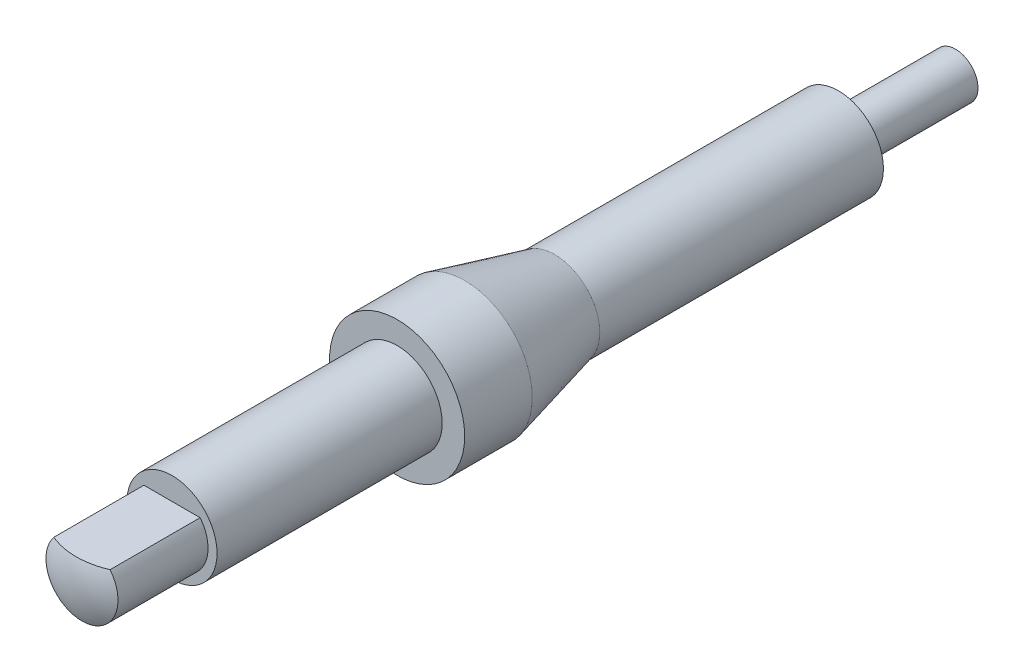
SolidWorks part; units mm, degrees
ref_plane "Front" through (0, 0, 0) normal (0, 0, 1) x (1, 0, 0)
ref_plane "Top" through (0, 0, 0) normal (0, 1, 0) x (1, 0, 0)
ref_plane "Right" through (0, 0, 0) normal (1, 0, 0) x (0, 0, -1)
sketch "Sketch1" plane through (0, 0, 0) normal (1, 0, 0) x (0, 0, -1)
  line L0 (-2.0578, 0) -> (195.2549, 0)
  line L2 (0, 8) -> (20, 8)
  line L3 (20, 8) -> (20, 10)
  line L4 (20, 10) -> (70, 10)
  line L5 (70, 10) -> (70, 15)
  line L6 (70, 15) -> (85, 15)
  line L7 (85, 15) -> (105, 10)
  line L8 (105, 10) -> (168, 10)
  line L9 (168, 10) -> (168, 5)
  line L10 (168, 5) -> (194, 5)
  arc A1 (0, 8) -> (-2.0578, 0) centre (14.5213, 0) ccw
  arc A2 (195.2549, 0) -> (194, 5) centre (184.6663, 0) ccw
  dimension "D1" = 20
  dimension "D2" = 50
  dimension "D3" = 15
  dimension "D4" = 20
  dimension "D5" = 26
  dimension "D6" = 63
  dimension "D8" = 10
  dimension "D9" = 15
  dimension "D10" = 10
  dimension "D11" = 5
revolve "Revolve2" add sketch "Sketch1" angle 360 about L0
sketch "Sketch3" plane through (0, 0, -20) normal (0, 0, 1) x (1, 0, 0)
  line L0 (-10, 0) -> (10, 0) construction
  line L1 (-10, 5) -> (10, 5)
  line L2 (-10, 5) -> (-10, 8.7709)
  line L3 (-10, 8.7709) -> (10, 8.7709)
  line L4 (10, 8.7709) -> (10, 5)
  circle A0 centre (0, 0) radius 10 construction
extrude "Cut-Extrude2" cut sketch "Sketch3" along normal blind 22
